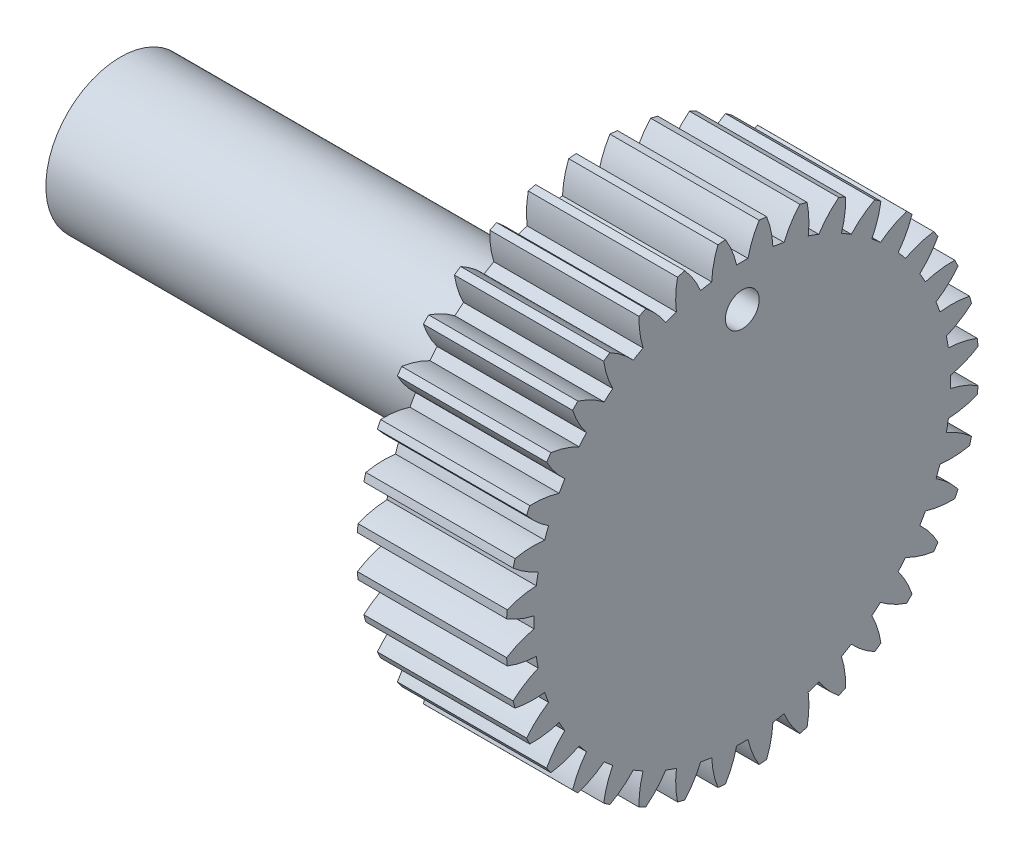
SolidWorks part; units mm, degrees
other "<Spur Gear_AM>-<Bore>"
ref_plane "Face" through (0, 0, 0) normal (0, 0, 1) x (1, 0, 0)
ref_plane "Dessus" through (0, 0, 0) normal (0, 1, 0) x (1, 0, 0)
ref_plane "Droite" through (0, 0, 0) normal (1, 0, 0) x (0, 0, -1)
inserted part "Spur Gear_AM"
sketch "Esquisse1" plane through (12, 0, 0) normal (1, 0, 0) x (0, 0, -1)
  circle A0 centre (0, 0) radius 6
extrude "Extrusion1" add sketch "Esquisse1" against normal blind 50
sketch "Esquisse2" plane through (12, 0, 0) normal (1, 0, 0) x (0, 0, -1)
  circle A0 centre (0, 13.4279) radius 1.3584
extrude "Enlèv. mat.-Extru.1" cut sketch "Esquisse2" against normal through all
sketch "Esquisse3" plane through (12, 0, 0) normal (1, 0, 0) x (0, 0, -1)
  circle A0 centre (0, 0) radius 18
